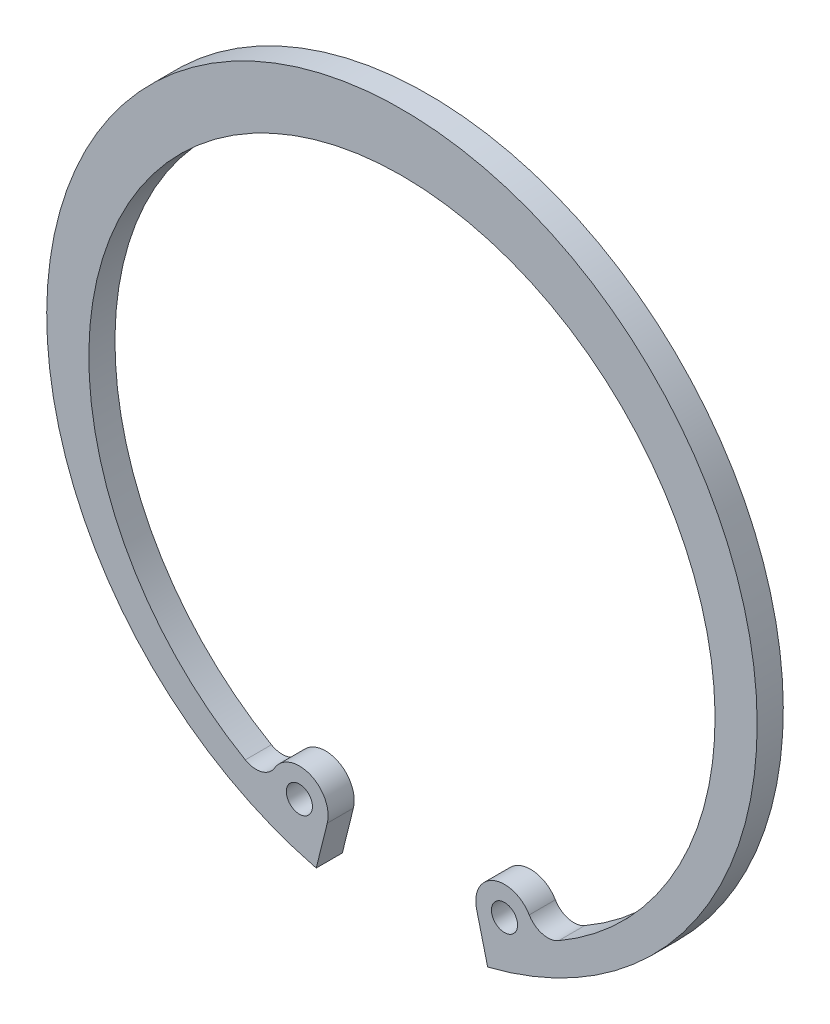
SolidWorks part; units mm, degrees
ref_plane "Plane1" through (0, 0, 0) normal (0, 0, 1) x (1, 0, 0)
ref_plane "Plane2" through (0, 0, 0) normal (0, 1, 0) x (1, 0, 0)
ref_plane "Plane3" through (0, 0, 0) normal (1, 0, 0) x (0, 0, -1)
extrude "Body" add sketch "BodySke" against normal blind 2.5
sketch "BodySke" plane through (0, 0, 0) normal (0, 0, 1) x (1, 0, 0)
  line L0 (-1.5431, 0) -> (1.5431, 0) construction
  line L1 (0, 0) -> (0, 28.5) construction
  line L2 (8.2042, -32.9953) -> (7.1479, -28.7473)
  line L3 (-8.2042, -32.9953) -> (-7.1479, -28.7473)
  line L4 (0, 0) -> (16.2601, -29.8598) construction
  line L5 (0, 0) -> (-16.2601, -29.8598) construction
  line L6 (-9.515, -26.8707) -> (-10.1183, -29.2968) construction
  line L7 (9.6355, -27.3553) -> (9.9978, -28.8121) construction
  arc A0 (-7.1479, -28.7473) -> (-12.1833, -26.6832) centre (-9.8167, -28.0837) ccw
  arc A1 (12.1833, -26.6832) -> (7.1479, -28.7473) centre (9.8167, -28.0837) ccw
  arc A2 (14.9449, -27.4447) -> (-14.9449, -27.4447) centre (0, -1.4685) ccw construction
  arc A3 (8.2042, -32.9953) -> (-8.2042, -32.9953) centre (0, 0) ccw
  circle A4 centre (9.8167, -28.0837) radius 1.25
  circle A5 centre (-9.8167, -28.0837) radius 1.25
  circle A6 centre (9.8167, -28.0837) radius 2.75 construction
  arc A7 (14.9899, -27.4188) -> (-14.9899, -27.4188) centre (0, -1.4685) ccw
  arc A8 (-9.8167, -28.0837) -> (9.8167, -28.0837) centre (0, 0) ccw construction
  arc A9 (-14.9899, -27.4188) -> (-12.1833, -26.6832) centre (-13.9583, -25.6328) ccw
  arc A10 (12.1833, -26.6832) -> (14.9899, -27.4188) centre (13.9583, -25.6328) ccw
  dimension "GrooveDia" = 68
  dimension "TipRad" = 2.75
  dimension "HoleOffsetRad" = 29.75
  dimension "HoleDia" = 2.5
  dimension "FilletRad" = 2.0625
  dimension "LargeRad" = 28.5
  dimension "SmallRad" = 31.25
  dimension "SmallAngle" = 57.141
  dimension "GapAngle" = 27.926
sketch "Clipboard" plane through (0, 0, 0) normal (0, 0, 1) x (1, 0, 0)
  line L0 (0, 0) -> (5.5, 0)
  line L1 (0, 0) -> (0, 2.75)
  line L2 (0, 0) -> (0, -7)
  circle A0 centre (0, 0) radius 1.25
  circle A1 centre (0, 0) radius 32.5
  dimension "HoleDia" = 2.5
  dimension "BoreDia" = 65
  dimension "LargeSection" = 5.5
  dimension "SmallSection" = 2.75
  dimension "LugSection" = 7
equation "' \"BoreDia@Clipboard\" = 10"
equation "' \"Thickness@Body\" = 1"
equation "' \"GrooveDia@BodySke\" = 10.4"
equation "' \"LugSection@Clipboard\" = 3.1"
equation "' \"LargeSection@Clipboard\" = 1.8"
equation "' \"HoleDia@Clipboard\" = 1.2"
equation "' \"BoreDia@Clipboard\" = 25"
equation "' \"Thickness@Body\" = 1.2"
equation "' \"GrooveDia@BodySke\" = 26.2"
equation "' \"LugSection@Clipboard\" = 4.4"
equation "' \"LargeSection@Clipboard\" = 3"
equation "' \"HoleDia@Clipboard\" = 2"
equation "\"SmallSection@Clipboard\" = \"LargeSection@Clipboard\" * 0.5"
equation "\"TipRad@BodySke\" = (\"LugSection@Clipboard\" - (\"GrooveDia@BodySke\" / 2  -  \"BoreDia@Clipboard\" / 2 ) ) / 2"
equation "\"HoleOffsetRad@BodySke\" = (\"GrooveDia@BodySke\" / 2) - \"LugSection@Clipboard\"  + \"TipRad@BodySke\""
equation "\"LargeRad@BodySke\" =  \"GrooveDia@BodySke\" / 2 -  \"LargeSection@Clipboard\""
equation "\"SmallRad@BodySke\" =  \"GrooveDia@BodySke\" / 2 -  \"SmallSection@Clipboard\""
equation "\"HoleDia@BodySke\" =  \"HoleDia@Clipboard\""
equation "\"FilletRad@BodySke\" = \"TipRad@BodySke\" * 0.75"
equation "\"GapAngle@BodySke\" = 360 - 0.965 * 360 * ( \"BoreDia@Clipboard\" /  \"GrooveDia@BodySke\")"
